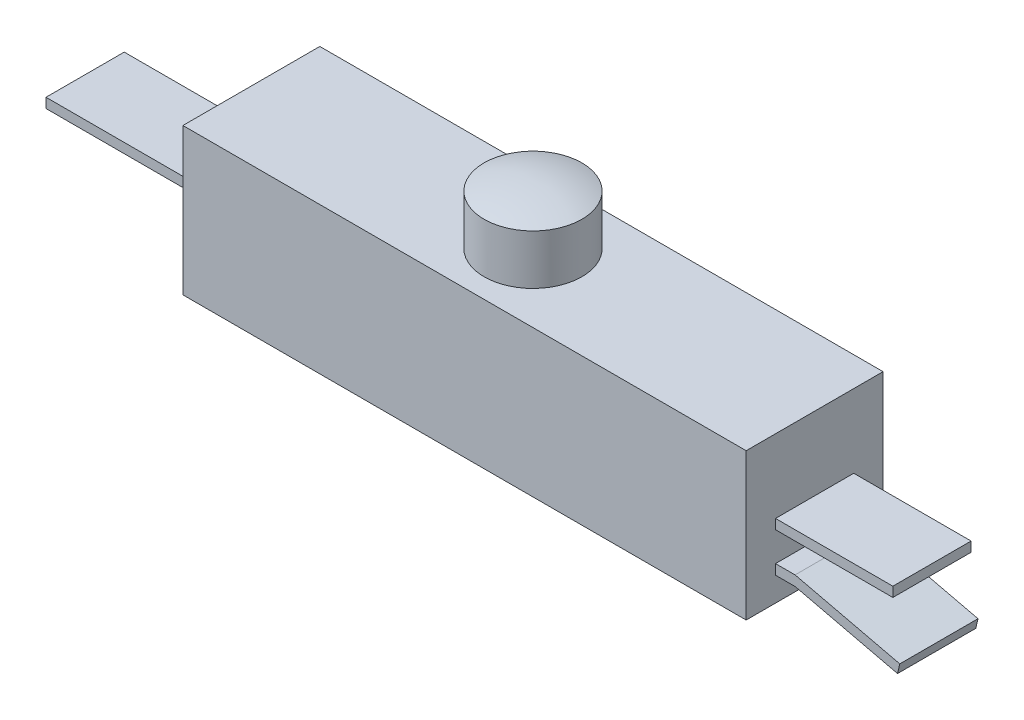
SolidWorks part; units mm, degrees
ref_plane "Front Plane" through (0, 0, 0) normal (0, 0, 1) x (1, 0, 0)
ref_plane "Top Plane" through (0, 0, 0) normal (0, 1, 0) x (1, 0, 0)
ref_plane "Right Plane" through (0, 0, 0) normal (1, 0, 0) x (0, 0, -1)
sketch "Sketch1" plane through (0, 0, 0) normal (0, 1, 0) x (1, 0, 0)
  line L1 (-22.86, -5.5563) -> (22.86, -5.5563)
  line L2 (-22.86, -5.5563) -> (-22.86, 5.5562)
  line L3 (-22.86, 5.5562) -> (22.86, 5.5562)
  line L4 (22.86, -5.5563) -> (22.86, 5.5562)
  line L5 (-22.86, -5.5563) -> (22.86, 5.5562) construction
  line L6 (-22.86, 5.5562) -> (22.86, -5.5563) construction
  point P0 (0, 0)
  dimension "D1" = 45.72
  dimension "D2" = 11.1125
extrude "Boss-Extrude1" add sketch "Sketch1" along normal blind 11.9062
sketch "Sketch2" plane through (0, 11.9062, 0) normal (0, 1, 0) x (1, 0, 0)
  line L0 (0, 5.5562) -> (0, -5.5563) construction
  line L1 (-22.86, 0) -> (22.86, 0) construction
  line L4 (22.86, -5.5563) -> (22.86, 5.5562)
  line L5 (22.86, 5.5562) -> (-22.86, 5.5562)
  line L6 (-22.86, 5.5562) -> (-22.86, -5.5563)
  line L7 (-22.86, -5.5563) -> (22.86, -5.5563)
  line L8 (22.86, -5.5563) -> (22.86, 5.5562)
  line L9 (22.86, 5.5562) -> (-22.86, 5.5562)
  line L10 (-22.86, 5.5562) -> (-22.86, -5.5563)
  line L11 (-22.86, -5.5563) -> (22.86, -5.5563)
  circle A0 centre (0, 0) radius 3.9688
  point P8 (0, 0)
  dimension "D2" = 7.9375
  dimension "D1" = 0
extrude "Boss-Extrude2" add sketch "Sketch2" along normal blind 4.7625 contours A0
sketch "Sketch3" plane through (0, 0, 0) normal (0, 0, 1) x (1, 0, 0)
  line L9 (-22.86, 0) -> (22.86, 0)
  line L10 (22.86, 0) -> (22.86, 11.9062)
  line L11 (22.86, 11.9062) -> (-22.86, 11.9062)
  line L12 (-22.86, 11.9062) -> (-22.86, 0)
  line L13 (-22.86, 0) -> (22.86, 0)
  line L14 (22.86, 0) -> (22.86, 11.9062)
  line L16 (-22.86, 11.9062) -> (-22.86, 0)
  line L20 (-22.86, 11.9062) -> (22.86, 11.9062) construction
  line L21 (-22.86, 11.9062) -> (22.86, 11.9062)
  line L22 (0, 11.9062) -> (0, 16.6687) construction
  line L23 (3.9688, 16.6687) -> (-3.9688, 16.6687) construction
  line L24 (3.9688, 15.875) -> (-4.1593, 15.875) construction
  line L27 (3.9688, 11.9062) -> (3.9688, 16.6687) construction
  line L28 (-4.1593, 15.875) -> (-4.1593, 17.145)
  line L29 (-4.1593, 17.145) -> (0, 17.145)
  line L30 (0, 17.145) -> (0, 16.6687)
  arc A0 (0, 16.6687) -> (-4.1593, 15.875) centre (0, 5.3746) ccw
  dimension "D1" = 0
  dimension "D2" = 0.7937
  dimension "D3" = 8.128
  dimension "D4" = 1.27
revolve "Cut-Revolve15" cut sketch "Sketch3" angle 360 about L22
sketch "Sketch4" plane through (0, 0, 0) normal (0, 0, 1) x (1, 0, 0)
  line L0 (24.4475, 2.7781) -> (32.9453, 0.7725)
  line L1 (-22.86, 5.9531) -> (-36.3537, 5.9531)
  line L2 (-22.86, 5.9531) -> (-22.86, 5.1594)
  line L3 (-22.86, 5.1594) -> (-36.3537, 5.1594)
  line L4 (-22.86, 0) -> (22.86, 0)
  line L5 (22.86, 0) -> (22.86, 11.9062)
  line L6 (22.86, 11.9062) -> (-22.86, 11.9062)
  line L7 (-22.86, 11.9062) -> (-22.86, 0)
  line L8 (-22.86, 0) -> (22.86, 0)
  line L9 (22.86, 0) -> (22.86, 11.9062)
  line L10 (22.86, 11.9062) -> (-22.86, 11.9062)
  line L11 (-22.86, 11.9062) -> (-22.86, 0)
  line L12 (-36.3537, 5.9531) -> (-36.3537, 5.1594)
  line L13 (22.86, 5.9531) -> (32.385, 5.9531)
  line L14 (22.86, 5.9531) -> (22.86, 5.1594)
  line L15 (22.86, 5.1594) -> (32.385, 5.1594)
  line L16 (32.385, 5.9531) -> (32.385, 5.1594)
  line L17 (22.86, 2.7781) -> (24.4475, 2.7781)
  line L18 (22.86, 2.7781) -> (22.86, 1.9626)
  line L19 (22.86, 1.9626) -> (24.4475, 1.9626)
  line L20 (24.4475, 2.7781) -> (24.4475, 1.9626)
  line L21 (24.4475, 2.7781) -> (24.2652, 2.0056)
  line L22 (32.9453, 0.7725) -> (32.763, 0)
  line L23 (24.2652, 2.0056) -> (32.763, 0)
  line L24 (22.86, 0) -> (32.763, 0) construction
  point P16 (0, 0)
  point P18 (0, 0)
  point P21 (0, 0)
  point P22 (-22.86, 5.9531)
  dimension "D2" = 2.3813
  dimension "D3" = 1.5875
  dimension "D4" = 8.7312
  dimension "D5" = 0.7937
  dimension "D6" = 9.525
  dimension "D7" = 0.7937
  dimension "D8" = 0.7937
  dimension "D9" = 13.4937
  dimension "D1" = 0
extrude "Boss-Extrude3" add sketch "Sketch4" along normal blind 3.175 and the other way blind 3.175 contours L13 L16 L15 L14 | L0 L22 L23 L21 | L20 L19 L18 L17 | L1 L12 L3 L2
